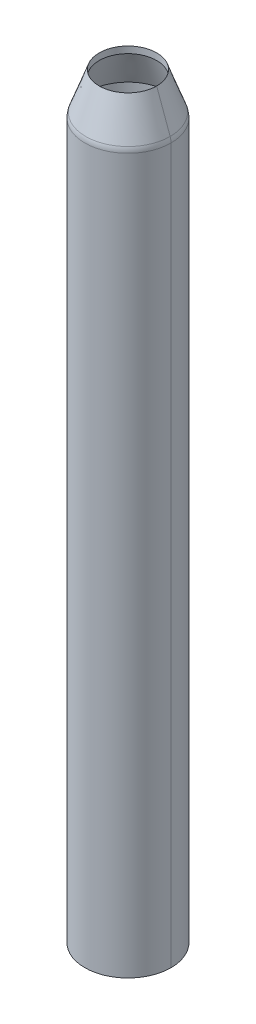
SolidWorks part; units mm, degrees
ref_plane "Plan de face" through (0, 0, 0) normal (0, 0, 1) x (1, 0, 0)
ref_plane "Plan de dessus" through (0, 0, 0) normal (0, 1, 0) x (1, 0, 0)
ref_plane "Plan de droite" through (0, 0, 0) normal (1, 0, 0) x (0, 0, -1)
sketch "Esquisse1" plane through (0, 0, 0) normal (0, 0, 1) x (1, 0, 0)
  line L0 (57, 0) -> (57, 947.7979)
  line L1 (38, 991.2286) -> (54, 947.2689)
  line L2 (38, 1000) -> (38, 991.2286)
  line L3 (57, 947.7979) -> (38, 1000)
  line L5 (57, 0) -> (-40.0031, 0) construction
  line L6 (54, 0) -> (54, 947.2689)
  line L10 (0, 3115.5399) -> (0, -377.5747) construction
  line L13 (57, 0) -> (54, 0)
  dimension "D2" = 1000
  dimension "D1" = 114
  dimension "D3" = 160
  dimension "D4" = 52.2021
  dimension "D6" = 3
  dimension "D8" = 3
revolve "tube" add sketch "Esquisse1" angle 360 about L10
sketch "Esquisse5" plane through (0, 0, 0) normal (0, 0, 1) x (1, 0, 0)
  line L0 (-57, 0) -> (57, 0) construction
  line L1 (0, 850) -> (0, 530) construction
  line L2 (0, 0) -> (0, 947.7979) construction
  line L3 (40, 850) -> (40, 530)
  line L4 (-40, 850) -> (-40, 530)
  arc A0 (40, 850) -> (-40, 850) centre (0, 850) ccw
  arc A1 (-40, 530) -> (40, 530) centre (0, 530) ccw
  point P4 (0, 690)
  dimension "D1" = 530
  dimension "D2" = 320
  dimension "D3" = 80
extrude "evidement_trappe" cut sketch "Esquisse5" against normal up to next
fillet "Congé1" radius 20 1 edges at (-57, 947.7979, 0)
